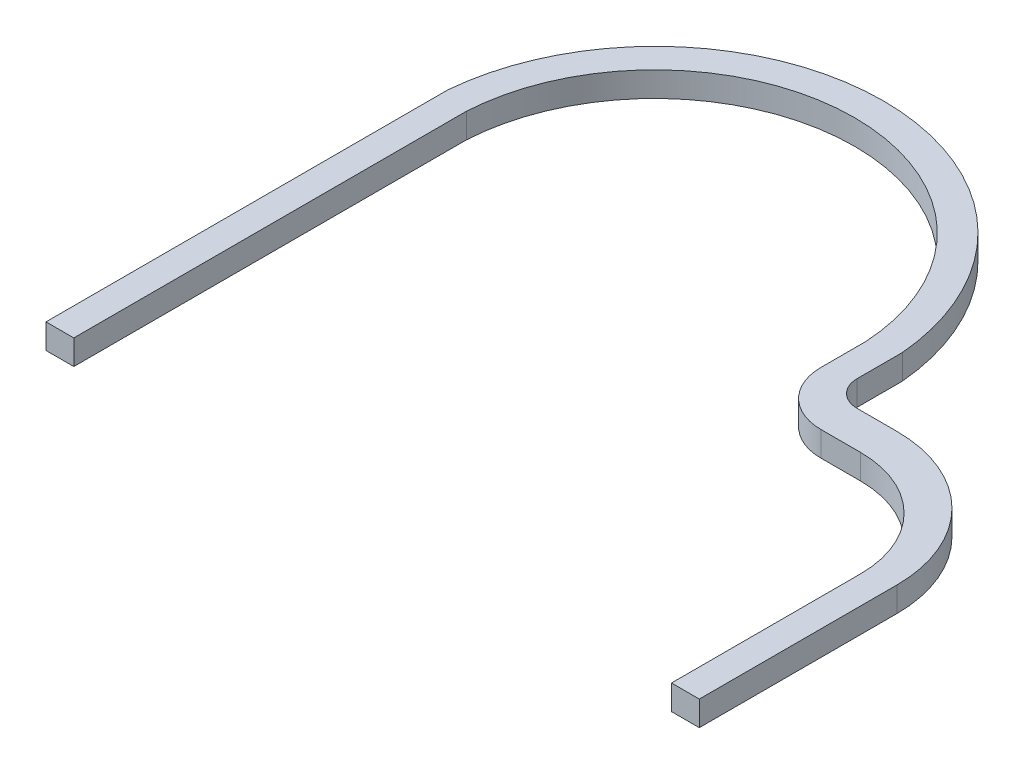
SolidWorks part; units mm, degrees
ref_plane "Front Plane" through (0, 0, 0) normal (0, 0, 1) x (1, 0, 0)
ref_plane "Top Plane" through (0, 0, 0) normal (0, 1, 0) x (1, 0, 0)
ref_plane "Right Plane" through (0, 0, 0) normal (1, 0, 0) x (0, 0, -1)
sketch "circuit outline" plane through (0, 0, 0) normal (0, 1, 0) x (1, 0, 0)
  line L0 (-69.85, 0) -> (-69.85, 15.875)
  line L1 (0, -31.75) -> (-69.85, -31.75)
  line L2 (0, -31.75) -> (0, 0)
  line L3 (0, 0) -> (-17.78, 0)
  line L4 (-69.85, -31.75) -> (-69.85, 0)
  line L5 (-25.4, 15.875) -> (-25.4, 7.62)
  arc A0 (-25.4, 15.875) -> (-69.85, 15.875) centre (-47.625, 15.875) ccw
  arc A1 (-17.78, 0) -> (-25.4, 7.62) centre (-17.78, 7.62) cw
  point P6 (-47.625, 38.1)
  dimension "D3" = 44.45
  dimension "D5" = 7.62
  dimension "D1" = 38.1
  dimension "D2" = 69.85
  dimension "D4" = 31.75
sketch "Sketch2" plane through (0, 0, 0) normal (0, 1, 0) x (1, 0, 0)
  line L0 (0, -31.75) -> (0, 0) construction
  line L1 (0, -31.75) -> (0, 0) construction
  line L2 (0, -31.75) -> (-69.85, -31.75) construction
  line L3 (-69.85, -31.75) -> (-69.85, 0) construction
  line L4 (-69.85, 0) -> (-69.85, 15.875) construction
  line L5 (-25.4, 15.875) -> (-25.4, 7.62) construction
  line L6 (0, 0) -> (-17.78, 0) construction
  line L7 (0, -31.75) -> (-69.85, -31.75) construction
  line L8 (-69.85, -31.75) -> (-69.85, 0) construction
  line L9 (-69.85, 0) -> (-69.85, 15.875) construction
  line L10 (-25.4, 15.875) -> (-25.4, 7.62) construction
  line L11 (0, 0) -> (-17.78, 0) construction
  line L12 (5.08, -36.83) -> (5.08, -10.16)
  line L13 (-10.16, 5.08) -> (-15.24, 5.08)
  line L14 (-20.32, 15.875) -> (-20.32, 10.16)
  line L15 (-74.93, 0) -> (-74.93, 15.875)
  line L16 (-74.93, -36.83) -> (-74.93, 0)
  line L17 (5.08, -36.83) -> (-74.93, -36.83)
  line L19 (-76.708, -38.608) -> (6.858, -38.608)
  line L20 (-76.708, -38.608) -> (-76.708, -35.433)
  line L21 (-18.542, 15.9538) -> (-18.542, 10.16)
  line L22 (-76.708, 0) -> (-76.708, 15.9538)
  line L23 (-76.708, -38.608) -> (-76.708, 0)
  line L24 (6.858, -38.608) -> (-76.708, -38.608)
  line L25 (6.858, -38.608) -> (6.858, -10.16)
  line L26 (-10.16, 6.858) -> (-15.24, 6.858)
  line L27 (-22.098, 14.7785) -> (-22.098, 9.0635)
  line L28 (-73.152, -1.0965) -> (-73.152, 14.7785)
  line L29 (-73.152, -36.1485) -> (-73.152, -1.0965)
  line L30 (3.302, -36.1485) -> (-73.152, -36.1485)
  line L31 (3.302, -36.1485) -> (3.302, -11.2565)
  line L32 (-10.16, 2.2055) -> (-15.24, 2.2055)
  line L33 (-76.708, -35.433) -> (6.858, -35.433)
  line L34 (6.858, -38.608) -> (6.858, -35.433)
  arc A0 (-25.4, 15.875) -> (-69.85, 15.875) centre (-47.625, 15.875) ccw construction
  arc A1 (-25.4, 7.62) -> (-17.78, 0) centre (-17.78, 7.62) ccw construction
  arc A2 (-25.4, 15.875) -> (-69.85, 15.875) centre (-47.625, 15.875) ccw construction
  arc A3 (-25.4, 7.62) -> (-17.78, 0) centre (-17.78, 7.62) ccw construction
  arc A5 (-20.32, 15.875) -> (-74.93, 15.875) centre (-47.625, 13.4126) ccw
  arc A6 (5.08, -10.16) -> (-10.16, 5.08) centre (-10.16, -10.16) ccw
  arc A8 (-15.24, 5.08) -> (-20.32, 10.16) centre (-15.24, 10.16) cw
  arc A9 (-15.24, 6.858) -> (-18.542, 10.16) centre (-15.24, 10.16) cw
  arc A10 (-18.542, 15.9538) -> (-76.708, 15.9538) centre (-47.625, 13.4126) ccw
  arc A11 (6.858, -10.16) -> (-10.16, 6.858) centre (-10.16, -10.16) ccw
  arc A12 (-15.24, 2.2055) -> (-22.098, 9.0635) centre (-15.24, 9.0635) cw
  arc A13 (-22.098, 14.7785) -> (-73.152, 14.7785) centre (-47.625, 13.335) ccw
  arc A14 (3.302, -11.2565) -> (-10.16, 2.2055) centre (-10.16, -11.2565) ccw
  dimension "D2" = 15.24
  dimension "D3" = 5.08
  dimension "D1" = 3.175
  dimension "D5" = 2.54
  dimension "D4" = 1.778
extrude "rim" add sketch "Sketch2" along normal blind 3.175 contours L25 A11 L26 A9 L21 A10 L22 L23 L24 A8 L13 A6 L12 L17 L16 L15 A5 L14 | L13 A8 L14 A5 L15 L16 L17 L12 A6 A14 L31 L30 L29 L28 A13 L27 A12 L32
